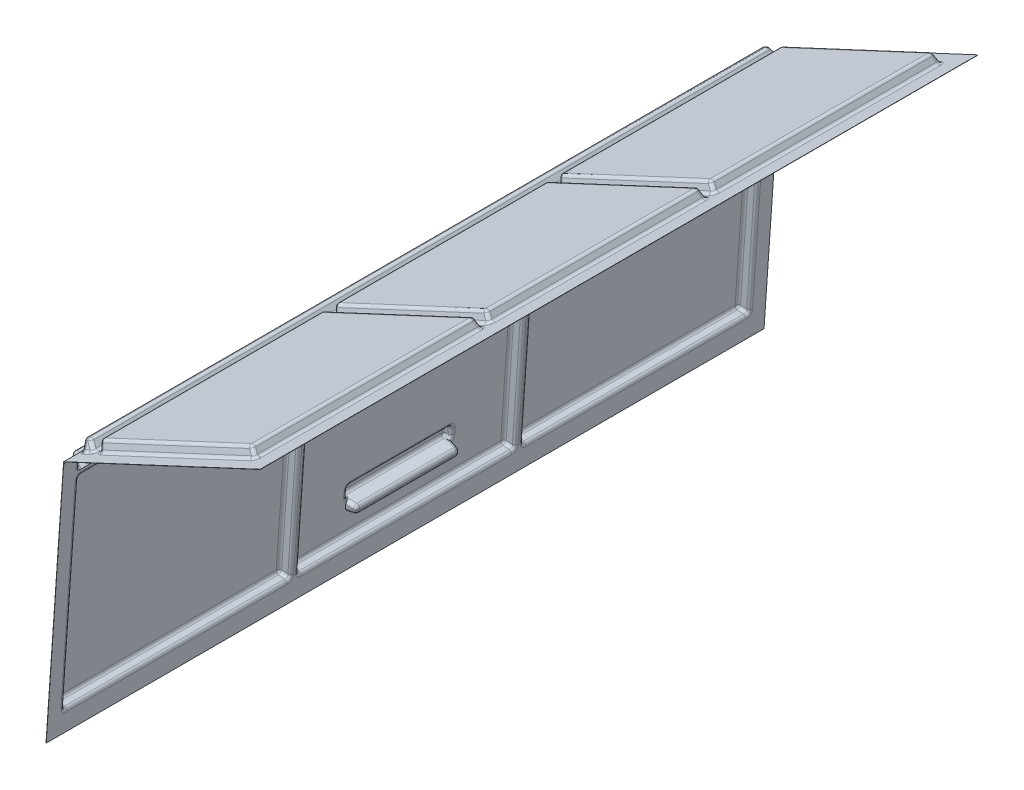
SolidWorks part; units mm, degrees
ref_plane "Plan de face" through (0, 0, 0) normal (0, 0, 1) x (1, 0, 0)
ref_plane "Plan de dessus" through (0, 0, 0) normal (0, 1, 0) x (1, 0, 0)
ref_plane "Plan de droite" through (0, 0, 0) normal (1, 0, 0) x (0, 0, -1)
sketch "Esquisse2" plane through (976.9195, -68.1059, 0) normal (-0.9976, 0.0695, 0) x (0, 0, 1)
  line L0 (-287.8758, 539.1032) -> (-287.8758, 154.1032) construction
  line L1 (-287.8758, 168.1032) -> (-1375.2758, 168.1032)
  line L2 (-287.8758, 168.1032) -> (-287.8758, 555.2911)
  line L3 (-287.8758, 555.2911) -> (-1375.2758, 555.2911)
  line L4 (-1375.2758, 168.1032) -> (-1375.2758, 555.2911)
  line L5 (-287.8758, 178.1032) -> (-1374.8758, 178.1032) construction
  line L6 (-291.0331, 555.2911) -> (-304.0331, 555.2911) construction
  line L7 (-1375.2758, 154.1032) -> (-1375.2758, 539.1032) construction
  dimension "D1" = 10
extrude "Boss.-Extru.1" add sketch "Esquisse2" along normal blind 0.25
sketch "Esquisse4" plane through (-3.1269, 6.702, 0) normal (-0.4228, 0.9062, 0) x (0.9062, 0.4228, 0)
  line L1 (1117.0576, 1375.2758) -> (1452.0576, 1375.2758)
  line L2 (1117.0576, 1375.2758) -> (1117.0576, 287.8758)
  line L3 (1117.0576, 287.8758) -> (1452.0576, 287.8758)
  line L4 (1452.0576, 1375.2758) -> (1452.0576, 287.8758)
  line L7 (1125.4987, 1375.2758) -> (937.7863, 1375.2758) construction
  line L8 (937.7863, 287.8758) -> (1125.4987, 287.8758) construction
  line L9 (1452.0576, 307.6182) -> (1452.0576, 1355.3333) construction
  dimension "D1" = 335
extrude "Boss.-Extru.2" add sketch "Esquisse4" along normal blind 0.25 separate body
sketch "Esquisse5" plane through (0, 0, -1375.2758) normal (0, 0, -1) x (-1, 0, 0)
  line L0 (-1015.2792, 482.1299) -> (-1015.5379, 485.8407)
  line L1 (-1015.5379, 485.8407) -> (-988.6105, 99.5903) construction
  line L2 (-1312.6491, 620.8721) -> (-1009.0658, 479.2309) construction
  line L3 (-1015.5379, 485.8407) -> (-1015.2885, 485.858)
  line L4 (-1015.2885, 485.858) -> (-1009.0658, 479.2309)
  line L5 (-1009.0658, 479.2309) -> (-1009.1715, 479.0044)
  line L6 (-1312.7548, 620.6455) -> (-1009.1715, 479.0044) construction
  line L7 (-1009.1715, 479.0044) -> (-1015.0003, 481.7239)
  line L8 (-1015.2885, 485.858) -> (-988.3611, 99.6077) construction
  line L9 (-1015.0003, 481.7239) -> (-1015.0202, 482.009)
  line L10 (-1015.0202, 482.009) -> (-1015.2792, 482.1299)
extrude "Enlèv. mat.-Extru.1" cut sketch "Esquisse5" against normal through all
sketch "Esquisse6" plane through (976.6701, -68.0885, 0) normal (-0.9976, 0.0695, 0) x (0, 0, 1)
  line L0 (-1375.2758, 551.4327) -> (-287.8758, 168.1032) construction
  line L1 (-287.8758, 551.5713) -> (-1375.2758, 168.1032) construction
  line L2 (-831.5758, 359.7679) -> (-484.0758, 359.7679) construction
  line L3 (-996.5758, 519.7679) -> (-666.5758, 519.7679)
  line L4 (-996.5758, 519.7679) -> (-996.5758, 199.7679)
  line L5 (-996.5758, 199.7679) -> (-666.5758, 199.7679)
  line L6 (-666.5758, 519.7679) -> (-666.5758, 199.7679)
  line L7 (-996.5758, 519.7679) -> (-666.5758, 199.7679) construction
  line L8 (-996.5758, 199.7679) -> (-666.5758, 519.7679) construction
  line L9 (-831.5758, 359.7679) -> (-831.5758, 519.7679) construction
  line L10 (-656.5758, 519.7679) -> (-311.5758, 519.7679)
  line L11 (-656.5758, 519.7679) -> (-656.5758, 199.7679)
  line L12 (-656.5758, 199.7679) -> (-311.5758, 199.7679)
  line L13 (-311.5758, 519.7679) -> (-311.5758, 199.7679)
  line L14 (-656.5758, 519.7679) -> (-311.5758, 199.7679) construction
  line L15 (-656.5758, 199.7679) -> (-311.5758, 519.7679) construction
  line L16 (-1006.5758, 199.7679) -> (-1351.5758, 199.7679)
  line L17 (-1351.5758, 519.7679) -> (-1351.5758, 199.7679)
  line L18 (-1006.5758, 519.7679) -> (-1006.5758, 199.7679)
  line L19 (-1006.5758, 519.7679) -> (-1351.5758, 519.7679)
  point P8 (-831.5758, 359.7679)
  dimension "D1" = 330
  dimension "D2" = 320
  dimension "D3" = 345
  dimension "D4" = 10
  dimension "D5" = 320
extrude "Boss.-Extru.3" add sketch "Esquisse6" along normal blind 15 draft 15
sketch "Esquisse7" plane through (-3.2326, 6.9286, 0) normal (-0.4228, 0.9062, 0) x (0.9062, 0.4228, 0)
  line L0 (1452.0576, 1375.2758) -> (1123.914, 287.8758) construction
  line L1 (1123.914, 1375.2758) -> (1452.0576, 287.8758) construction
  line L2 (1287.9858, 831.5758) -> (1287.9858, 484.0758) construction
  line L3 (1417.9858, 996.5758) -> (1157.9858, 996.5758)
  line L4 (1417.9858, 996.5758) -> (1417.9858, 666.5758)
  line L5 (1417.9858, 666.5758) -> (1157.9858, 666.5758)
  line L6 (1157.9858, 996.5758) -> (1157.9858, 666.5758)
  line L7 (1417.9858, 996.5758) -> (1157.9858, 666.5758) construction
  line L8 (1417.9858, 666.5758) -> (1157.9858, 996.5758) construction
  line L9 (1287.9858, 831.5758) -> (1452.0576, 831.5758) construction
  line L10 (1417.9858, 656.5758) -> (1157.9858, 656.5758)
  line L11 (1417.9858, 656.5758) -> (1417.9858, 311.5758)
  line L12 (1417.9858, 311.5758) -> (1157.9858, 311.5758)
  line L13 (1157.9858, 656.5758) -> (1157.9858, 311.5758)
  line L14 (1417.9858, 656.5758) -> (1157.9858, 311.5758) construction
  line L15 (1417.9858, 311.5758) -> (1157.9858, 656.5758) construction
  line L16 (1452.0576, 287.8758) -> (1452.0576, 1375.2758) construction
  line L17 (1417.9858, 1006.5758) -> (1157.9858, 1006.5758)
  line L18 (1417.9858, 1351.5758) -> (1157.9858, 1351.5758)
  line L19 (1157.9858, 1006.5758) -> (1157.9858, 1351.5758)
  line L20 (1417.9858, 1006.5758) -> (1417.9858, 1351.5758)
  point P8 (1287.9858, 831.5758)
  dimension "D1" = 260
  dimension "D2" = 330
  dimension "D3" = 260
  dimension "D4" = 345
  dimension "D5" = 10
extrude "Boss.-Extru.4" add sketch "Esquisse7" along normal blind 15
sketch "Esquisse8" plane through (0, 0, -287.8758) normal (0, 0, 1) x (1, 0, 0)
  line L0 (1015.0202, 482.009) -> (1300.3649, 285.9856) construction
  line L1 (1015.0003, 481.7239) -> (1312.7548, 620.6455) construction
  line L2 (988.6105, 99.5903) -> (1015.2792, 482.1299) construction
  line L3 (1014.8497, 475.9685) -> (1015.2593, 481.8447)
  line L4 (1015.2593, 481.8447) -> (1020.5974, 484.3353)
  arc A0 (1020.5974, 484.3353) -> (1014.8497, 475.9685) centre (1024.8255, 475.2731) ccw
  point P5 (1015.2593, 481.8447)
  dimension "D1" = 20
extrude "Boss.-Extru.5" add sketch "Esquisse8" against normal up to surface (1087.4 mm away)
sketch "Esquisse9" plane through (0, 0, -311.5758) normal (0, 0, 1) x (1, 0, 0)
  line L0 (1018.9692, 483.8515) -> (1012.627, 497.4448)
  line L1 (1312.6491, 620.8721) -> (1015.0202, 482.009) construction
  line L2 (1012.627, 497.4448) -> (1030.7514, 505.9009)
  line L3 (1030.7514, 505.9009) -> (1037.0935, 492.3077)
  line L4 (1039.8136, 510.129) -> (1046.1557, 496.5358) construction
  line L5 (1037.0935, 492.3077) -> (1018.9692, 483.8515)
  line L7 (1015.0202, 482.009) -> (1016.583, 480.9354) construction
  line L8 (1013.3262, 457.7103) -> (1014.7171, 477.6619)
  line L9 (998.3625, 458.7535) -> (1013.3262, 457.7103)
  line L10 (1014.7171, 477.6619) -> (999.7534, 478.7051)
  line L11 (999.7534, 478.7051) -> (998.3625, 458.7535)
  arc A0 (1020.5974, 484.3353) -> (1014.8497, 475.9685) centre (1024.8255, 475.2731) ccw construction
  dimension "D1" = 15
  dimension "D2" = 20
  dimension "D3" = 10
  dimension "D4" = 120.5
extrude "Boss.-Extru.6" add sketch "Esquisse9" against normal up to surface (1040 mm away)
sketch "Esquisse10" plane through (961.7065, -67.0453, 0) normal (-0.9976, 0.0695, 0) x (0, 0, 1)
  line L0 (-831.5758, 515.7487) -> (-831.5758, 199.7679) construction
  line L1 (-670.595, 515.7487) -> (-992.5565, 515.7487) construction
  line L2 (-996.5758, 199.7679) -> (-666.5758, 199.7679) construction
  line L3 (-992.5565, 203.7872) -> (-670.595, 203.7872) construction
  line L4 (-751.5758, 233.7872) -> (-911.5758, 233.7872)
  line L5 (-751.5758, 233.7872) -> (-751.5758, 248.7872)
  line L6 (-751.5758, 248.7872) -> (-911.5758, 248.7872)
  line L7 (-911.5758, 233.7872) -> (-911.5758, 248.7872)
  line L8 (-751.5758, 233.7872) -> (-911.5758, 248.7872) construction
  line L9 (-751.5758, 248.7872) -> (-911.5758, 233.7872) construction
  point P6 (-831.5758, 241.2872)
  dimension "D1" = 160
  dimension "D2" = 15
  dimension "D3" = 30
extrude "Enlèv. mat.-Extru.2" cut sketch "Esquisse10" against normal blind 14
sketch "Esquisse11" plane through (961.7065, -67.0453, 0) normal (-0.9976, 0.0695, 0) x (0, 0, 1)
  line L0 (-831.5758, 248.7872) -> (-831.5758, 258.7872) construction
  line L1 (-751.5758, 248.7872) -> (-911.5758, 248.7872) construction
  line L3 (-911.5758, 268.7872) -> (-751.5758, 268.7872)
  line L4 (-911.5758, 268.7872) -> (-911.5758, 248.7872)
  line L5 (-911.5758, 248.7872) -> (-751.5758, 248.7872)
  line L6 (-751.5758, 268.7872) -> (-751.5758, 248.7872)
  line L7 (-911.5758, 268.7872) -> (-751.5758, 248.7872) construction
  line L8 (-911.5758, 248.7872) -> (-751.5758, 268.7872) construction
  dimension "D1" = 10
extrude "Boss.-Extru.8" add sketch "Esquisse11" along normal blind 10
draft "Dépouille1" type of draft neutral plane draft angle 15 faces to draft 12 parameters "D1"=15
draft "Dépouille2" type of draft neutral plane draft angle 15 faces to draft 12 parameters "D1"=15
draft "Dépouille3" type of draft neutral plane draft angle 10 faces to draft 7 parameters "D1"=10
draft "Dépouille4" type of draft neutral plane draft angle 20 faces to draft 4 parameters "D1"=20
draft "Dépouille5" type of draft neutral plane draft angle 20 faces to draft 4 parameters "D1"=20
fillet "Congé26" radius 5 8 edges at (975.3504, 200.5593, -752.4574) (974.0821, 182.3667, -752.4574) (969.7283, 191.8107, -753.339) (970.3012, 200.0275, -831.5758) (969.1555, 183.5939, -831.5758) (974.0821, 182.3667, -910.6941) (975.3504, 200.5593, -910.6941) (969.7283, 191.8107, -909.8125)
fillet "Congé29" radius 5 5 edges at (992.1032, 167.6648, -831.5758) (992.4532, 172.684, -909.1072) (985.0344, 166.9203, -910.3415) (985.0344, 166.9203, -752.8101) (992.4532, 172.684, -754.0443)
fillet "Congé31" radius 5 12 edges at (992.3242, 177.8225, -756.0896) (989.5702, 178.6251, -753.5417) (981.8314, 182.448, -752.0562) (979.7041, 191.1153, -751.5758) (980.2999, 199.6612, -753.0091) (980.3996, 201.0911, -831.5758) (980.2999, 199.6612, -910.1424) (979.7041, 191.1153, -911.5758) (981.8314, 182.448, -911.0953) (990.2574, 178.3769, -909.2905) (992.3242, 177.8225, -907.0619) (992.8031, 177.7032, -831.5758)
fillet "Congé32" radius 5 36 edges at (986.7269, 291.8515, -315.595) (997.5748, 447.4546, -484.0758) (975.8791, 136.2484, -484.0758) (986.7269, 291.8515, -652.5565) (997.5748, 447.4546, -831.5758) (986.7269, 291.8515, -670.595) (975.8791, 136.2484, -831.5758) (986.7269, 291.8515, -992.5565) (986.7269, 291.8515, -1010.595) (997.5748, 447.4546, -1179.0758) (975.8791, 136.2484, -1179.0758) (986.7269, 291.8515, -1347.5565) (983.2212, 133.7221, -654.5662) (983.2212, 133.7221, -313.5854) (990.5632, 131.1957, -484.0758) (1012.818, 450.4209, -1179.0758) (1001.6906, 290.8083, -1006.5758) (1005.1964, 448.9378, -1008.5854) (1005.1964, 448.9378, -654.5662) (1012.818, 450.4209, -831.5758) (1005.1964, 448.9378, -668.5854) (1001.6906, 290.8083, -666.5758) (1001.6906, 290.8083, -311.5758) (1012.818, 450.4209, -484.0758) (1005.1964, 448.9378, -313.5854) (983.2212, 133.7221, -668.5854) (1001.6906, 290.8083, -656.5758) (983.2212, 133.7221, -1008.5854) (1001.6906, 290.8083, -996.5758) (983.2212, 133.7221, -994.5662) (990.5632, 131.1957, -831.5758) (1005.1964, 448.9378, -994.5662) (1005.1964, 448.9378, -1349.5662) (990.5632, 131.1957, -1179.0758) (1001.6906, 290.8083, -1351.5758) (983.2212, 133.7221, -1349.5662)
fillet "Congé33" radius 5 36 edges at (1046.1557, 496.5358, -1179.0758) (1043.4559, 511.8284, -1179.0758) (1046.1557, 496.5358, -831.5758) (1043.4559, 511.8284, -831.5758) (1044.8058, 504.1821, -313.5854) (1157.622, 565.0942, -315.595) (1276.7804, 612.4131, -313.5854) (1163.9641, 551.501, -311.5758) (1044.8058, 504.1821, -1349.5662) (1163.9641, 551.501, -1351.5758) (1157.622, 565.0942, -1347.5565) (1163.9641, 551.501, -656.5758) (1157.622, 565.0942, -652.5565) (1163.9641, 551.501, -996.5758) (1157.622, 565.0942, -992.5565) (1044.8058, 504.1821, -994.5662) (1276.7804, 612.4131, -1349.5662) (1163.9641, 551.501, -1006.5758) (1157.622, 565.0942, -1010.595) (1044.8058, 504.1821, -1008.5854) (1276.7804, 612.4131, -994.5662) (1276.7804, 612.4131, -1008.5854) (1281.7726, 606.4662, -1179.0758) (1271.7881, 618.3601, -1179.0758) (1281.7726, 606.4662, -831.5758) (1271.7881, 618.3601, -831.5758) (1163.9641, 551.501, -666.5758) (1157.622, 565.0942, -670.595) (1276.7804, 612.4131, -668.5854) (1276.7804, 612.4131, -654.5662) (1281.7726, 606.4662, -484.0758) (1271.7881, 618.3601, -484.0758) (1044.8058, 504.1821, -654.5662) (1044.8058, 504.1821, -668.5854) (1046.1557, 496.5358, -484.0758) (1043.4559, 511.8284, -484.0758)
fillet "Congé38" radius 5 3 edges at (1014.0217, 467.6861, -311.5758) (1014.0217, 467.6861, -1351.5758) (1014.7171, 477.6619, -831.5758)
fillet "Congé39" radius 5 24 edges at (1013.8591, 478.3564, -1352.2089) (1012.447, 458.1015, -310.9426) (1012.447, 458.1015, -1352.2089) (1013.8591, 478.3564, -310.9426) (1005.3628, 474.9775, -1348.2473) (999.058, 468.7293, -317.0353) (1004.4349, 461.6668, -314.9043) (998.7422, 464.1999, -831.5758) (1004.4349, 461.6668, -1348.2473) (999.058, 468.7293, -1346.1162) (999.3737, 473.2588, -831.5758) (1005.3628, 474.9775, -314.9043) (1021.6892, 501.6728, -317.0353) (1017.5746, 499.7531, -831.5758) (1018.2719, 491.8023, -314.3055) (1031.4487, 497.9501, -314.3055) (1031.4487, 497.9501, -1348.846) (1028.0313, 488.0796, -1351.5758) (1021.6892, 501.6728, -1346.1162) (1025.8038, 503.5926, -831.5758) (1037.0935, 492.3077, -831.5758) (1028.0313, 488.0796, -311.5758) (1018.9692, 483.8515, -831.5758) (1018.2719, 491.8023, -1348.846)
shell "Coque4" thickness 0.25
ref_plane "Plan1" through (0, 0, -831.5758) normal (0, 0, 1) x (1, 0, 0)
